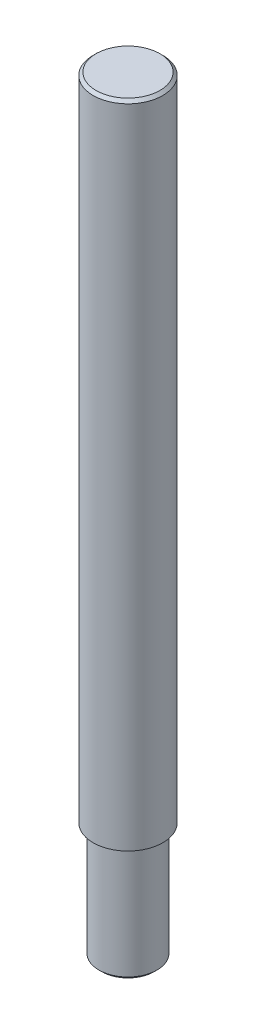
SolidWorks part; units mm, degrees
ref_plane "Front" through (0, 0, 0) normal (0, 0, 1) x (1, 0, 0)
ref_plane "Top" through (0, 0, 0) normal (0, 1, 0) x (1, 0, 0)
ref_plane "Right" through (0, 0, 0) normal (1, 0, 0) x (0, 0, -1)
sketch "Sketch1" plane through (0, 0, 0) normal (0, 1, 0) x (1, 0, 0)
  circle A0 centre (0, 0) radius 2.5
extrude "Extrude1" add sketch "Sketch1" against normal blind 10
sketch "Sketch2" plane through (0, 0, 0) normal (0, 1, 0) x (-1, 0, 0)
  circle A0 centre (0, 0) radius 3
extrude "Extrude2" add sketch "Sketch2" along normal blind 56
chamfer "Chamfer1" distance 0.25 angle 45 1 edges at (0, 56, 3)
chamfer "Chamfer2" distance 0.25 angle 45 1 edges at (0, -10, 2.5)
